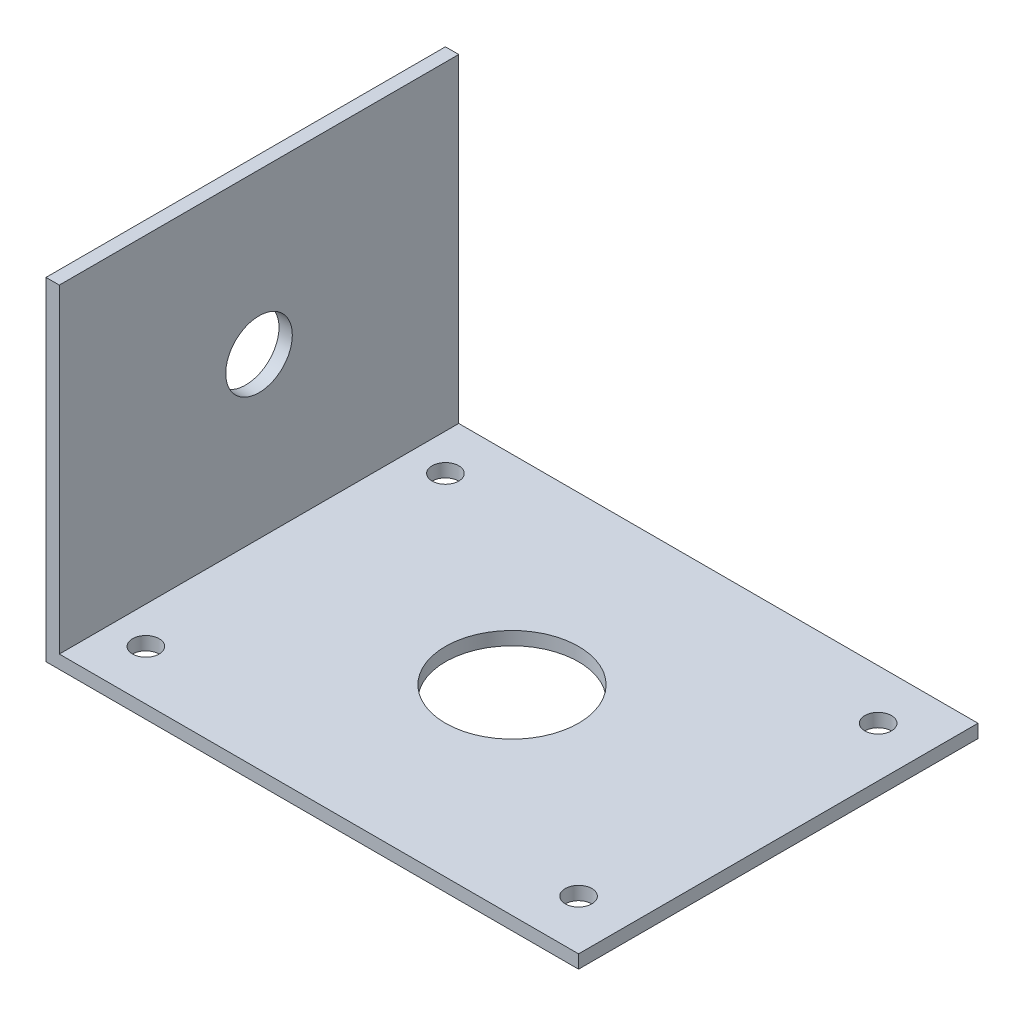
SolidWorks part; units mm, degrees
ref_plane "Front Plane" through (0, 0, 0) normal (0, 0, 1) x (1, 0, 0)
ref_plane "Top Plane" through (0, 0, 0) normal (0, 1, 0) x (1, 0, 0)
ref_plane "Right Plane" through (0, 0, 0) normal (1, 0, 0) x (0, 0, -1)
sketch "Sketch1" plane through (0, 0, 0) normal (0, 0, 1) x (1, 0, 0)
  line L0 (0, 63.5) -> (0, 0)
  line L1 (0, 0) -> (101.6, 0)
  dimension "D1" = 63.5
  dimension "D2" = 101.6
extrude "Extrude-Thin1" add sketch "Sketch1" along normal blind 76.2 thin
sketch "Sketch2" plane through (2.54, 0, 0) normal (1, 0, 0) x (0, 0, -1)
  line L0 (-76.2, 63.5) -> (0, 2.54) construction
  circle A0 centre (-38.1, 33.02) radius 6.35
  dimension "D1" = 12.7
extrude "Cut-Extrude1" cut sketch "Sketch2" against normal through all
sketch "Sketch3" plane through (0, 2.54, 0) normal (0, 1, 0) x (1, 0, 0)
  line L0 (0, -76.2) -> (101.6, 0) construction
  circle A0 centre (50.8, -38.1) radius 12.7
  dimension "D1" = 25.4
extrude "Cut-Extrude2" cut sketch "Sketch3" against normal through all
sketch "Sketch4" plane through (0, 2.54, 0) normal (0, 1, 0) x (1, 0, 0)
  line L4 (101.6, 0) -> (2.54, 0)
  line L5 (2.54, 0) -> (2.54, -76.2)
  line L6 (2.54, -76.2) -> (101.6, -76.2)
  line L7 (101.6, -76.2) -> (101.6, 0)
  line L8 (101.6, 0) -> (2.54, 0)
  line L9 (2.54, 0) -> (2.54, -76.2)
  line L10 (2.54, -76.2) -> (101.6, -76.2)
  line L11 (101.6, -76.2) -> (101.6, 0)
  circle A0 centre (9.525, -9.525) radius 2.54 construction
  circle A1 centre (9.525, -66.675) radius 2.54 construction
  circle A2 centre (92.075, -66.675) radius 2.54 construction
  circle A3 centre (92.075, -9.525) radius 2.54 construction
  circle A4 centre (9.525, -9.525) radius 2.54
  circle A5 centre (9.525, -66.675) radius 2.54
  circle A6 centre (92.075, -66.675) radius 2.54
  circle A7 centre (92.075, -9.525) radius 2.54
  dimension "D1" = 0
extrude "Cut-Extrude3" cut sketch "Sketch4" against normal through all contours A5 | A4 | A7 | A6
